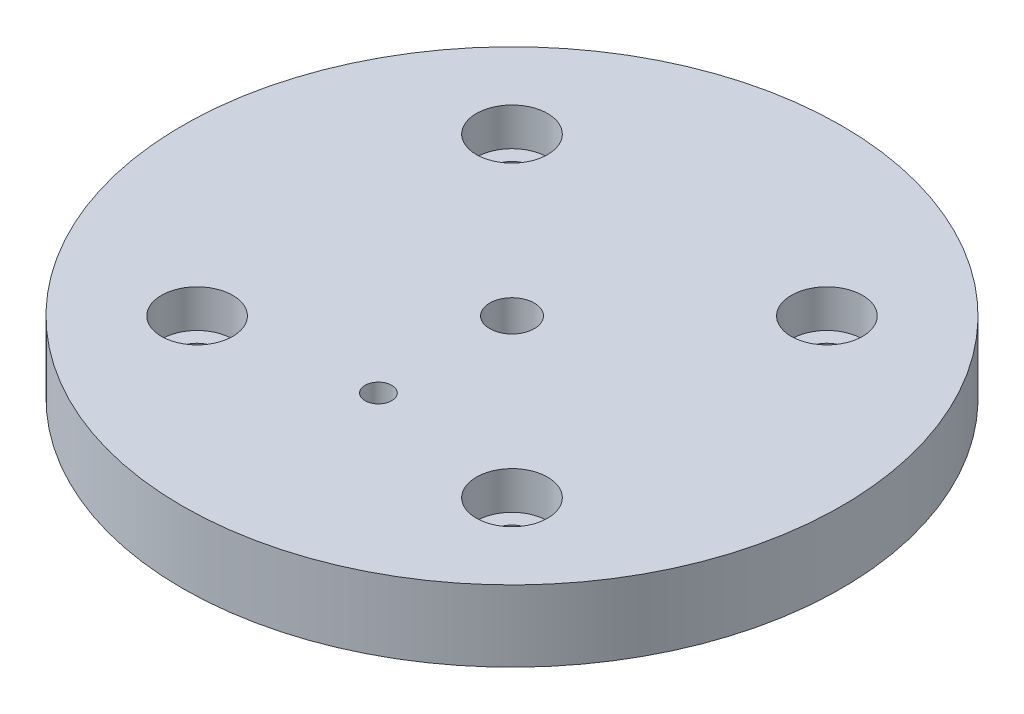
SolidWorks part; units mm, degrees
ref_plane "Front Plane" through (0, 0, 0) normal (0, 0, 1) x (1, 0, 0)
ref_plane "Top Plane" through (0, 0, 0) normal (0, 1, 0) x (1, 0, 0)
ref_plane "Right Plane" through (0, 0, 0) normal (1, 0, 0) x (0, 0, -1)
sketch "Sketch2" plane through (0, 0, 0) normal (0, 1, 0) x (1, 0, 0)
  circle A0 centre (0, 0) radius 37
  dimension "D1" = 74
extrude "Boss-Extrude2" add sketch "Sketch2" along normal blind 8
hole_wizard "CBORE for M4 SHCS1" positions "Sketch3" profile "Sketch4" counterbore size "M4" standard "ANSI Metric"
sketch "Sketch3" plane through (0, 8, 0) normal (0, 1, 0) x (1, 0, 0)
  line L0 (-17.6777, 17.6777) -> (17.6777, 17.6777) construction
  line L1 (17.6777, 17.6777) -> (17.6777, -17.6777) construction
  line L2 (17.6777, -17.6777) -> (-17.6777, -17.6777) construction
  line L3 (-17.6777, -17.6777) -> (-17.6777, 17.6777) construction
  line L5 (-17.6777, 17.6777) -> (17.6777, -17.6777) construction
  line L7 (17.6777, 17.6777) -> (-17.6777, -17.6777) construction
  point P0 (-17.6777, 17.6777)
  point P2 (17.6777, 17.6777)
  point P4 (-17.6777, -17.6777)
  point P6 (17.6777, -17.6777)
  point P18 (0, 17.6777)
  point P20 (-17.6777, 0)
  dimension "D1" = 50
sketch "Sketch4" plane through (-17.6777, 8, -17.6777) normal (1, 0, 0) x (0, 0, 1)
  line L0 (0, 0) -> (0, 8)
  line L1 (0, 8) -> (2.25, 8)
  line L3 (2.25, 8) -> (2.25, 4.25)
  line L4 (2.25, 4.25) -> (4, 4.25)
  line L5 (4, 4.25) -> (4, 0)
  line L7 (4, 0) -> (0, 0)
  line L11 (0, -6.35) -> (0, 107.95) construction
  dimension "Thru Hole Dia." = 4.5
  dimension "Thru Hole Depth" = 8
  dimension "C'Bore Dia." = 8
  dimension "C'Bore Depth" = 4.25
hole_wizard "M6x1.0 Tapped Hole1" positions "Sketch7" profile "Sketch8" tap size "M6x1.0" standard "ANSI Metric"
sketch "Sketch7" plane through (0, 8, 0) normal (0, 1, 0) x (1, 0, 0)
  point P0 (0, 0)
sketch "Sketch8" plane through (0, 8, 0) normal (1, 0, 0) x (0, 0, 1)
  line L0 (0, 0) -> (0, 8)
  line L1 (0, 8) -> (2.5, 8)
  line L2 (2.5, 8) -> (2.5, 0)
  line L5 (2.5, 0) -> (0, 0)
  line L11 (0, -6.35) -> (0, 107.95) construction
  dimension "Thru Tap Drill Dia." = 5
  dimension "Thru Tap Drill Depth" = 8
hole_wizard "Ø3.0mm Dowel Hole1" positions "Sketch9" profile "Sketch10" hole size "Ø3.0" standard "ANSI Metric"
sketch "Sketch9" plane through (0, 8, 0) normal (0, 1, 0) x (1, 0, 0)
  line L0 (0, 0) -> (0, -15) construction
  point P0 (0, -15)
  dimension "D1" = 15
sketch "Sketch10" plane through (0, 8, 15) normal (1, 0, 0) x (0, 0, 1)
  line L0 (0, 0) -> (0, 3.9013)
  line L1 (0, 3.9013) -> (1.5, 3)
  line L2 (1.5, 3) -> (1.5, 0)
  line L5 (1.5, 0) -> (0, 0)
  line L10 (0, 3.9013) -> (-1.5, 3) construction
  line L11 (0, -6.35) -> (0, 107.95) construction
  dimension "Hole Dia." = 3
  dimension "Hole Depth" = 3
  dimension "Drill Angle" = 118
